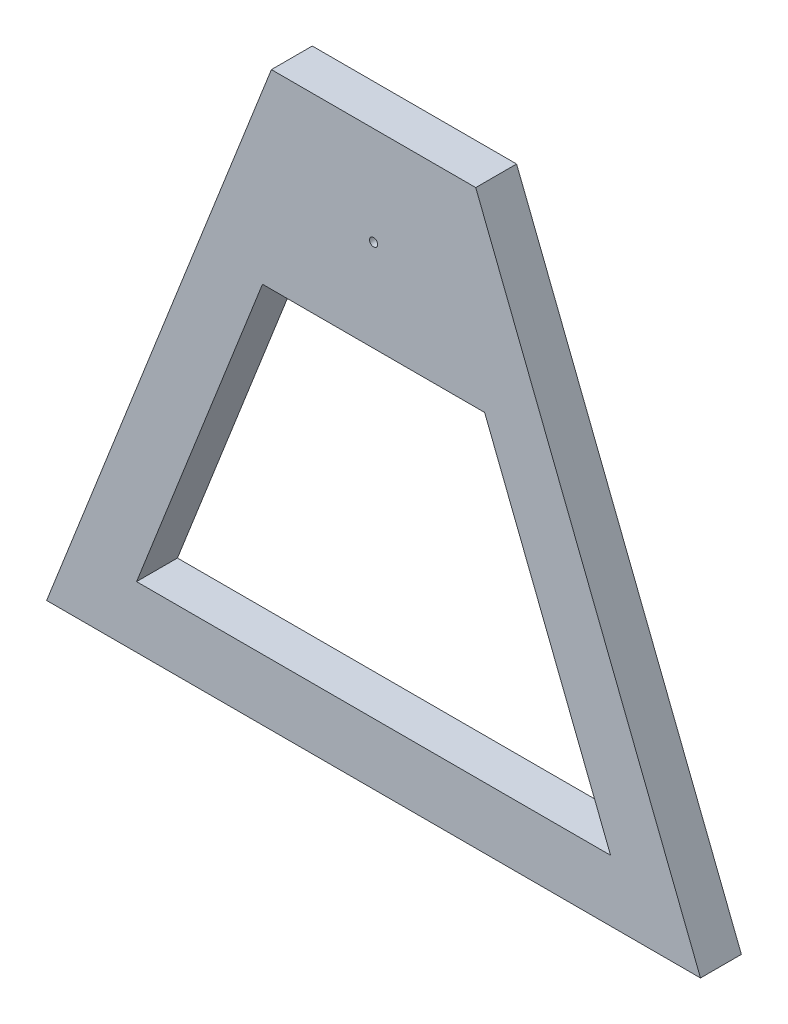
SolidWorks part; units mm, degrees
ref_plane "Front Plane" through (0, 0, 0) normal (0, 0, 1) x (1, 0, 0)
ref_plane "Top Plane" through (0, 0, 0) normal (0, 1, 0) x (1, 0, 0)
ref_plane "Right Plane" through (0, 0, 0) normal (1, 0, 0) x (0, 0, -1)
sketch "Sketch1" plane through (0, 0, 0) normal (0, 0, 1) x (1, 0, 0)
  line L0 (-800, 0) -> (800, 0)
  line L1 (800, 0) -> (250, 1400)
  line L2 (250, 1400) -> (-250, 1400)
  line L3 (-250, 1400) -> (-800, 0)
  point P3 (0, 1400)
  dimension "D1" = 1400
  dimension "D2" = 1600
  dimension "D3" = 500
extrude "Boss-Extrude1" add sketch "Sketch1" along normal blind 100
sketch "Sketch4" plane through (0, 0, 0) normal (0, 0, 1) x (1, 0, 0)
  line L0 (-579.9113, 150) -> (579.9113, 150)
  line L1 (579.9113, 150) -> (271.7778, 934.34)
  line L2 (271.7778, 934.34) -> (-271.7778, 934.34)
  line L3 (-271.7778, 934.34) -> (-579.9113, 150)
  line L4 (-425.8445, 542.17) -> (-565.4573, 597.0179) construction
  line L5 (-250, 1400) -> (-800, 0) construction
  line L6 (0, 150) -> (0, 0) construction
  point P2 (0, 150)
  point P5 (0, 934.34)
  point P13 (-425.8445, 542.17)
  dimension "D1" = 150
extrude "Cut-Extrude2" cut sketch "Sketch4" along normal through all contours L3 L0 L1 L2
sketch "Sketch5" plane through (0, 0, 100) normal (0, 0, 1) x (1, 0, 0)
  circle A1 centre (0, 1159.34) radius 10
extrude "Cut-Extrude3" cut sketch "Sketch5" against normal up to next
